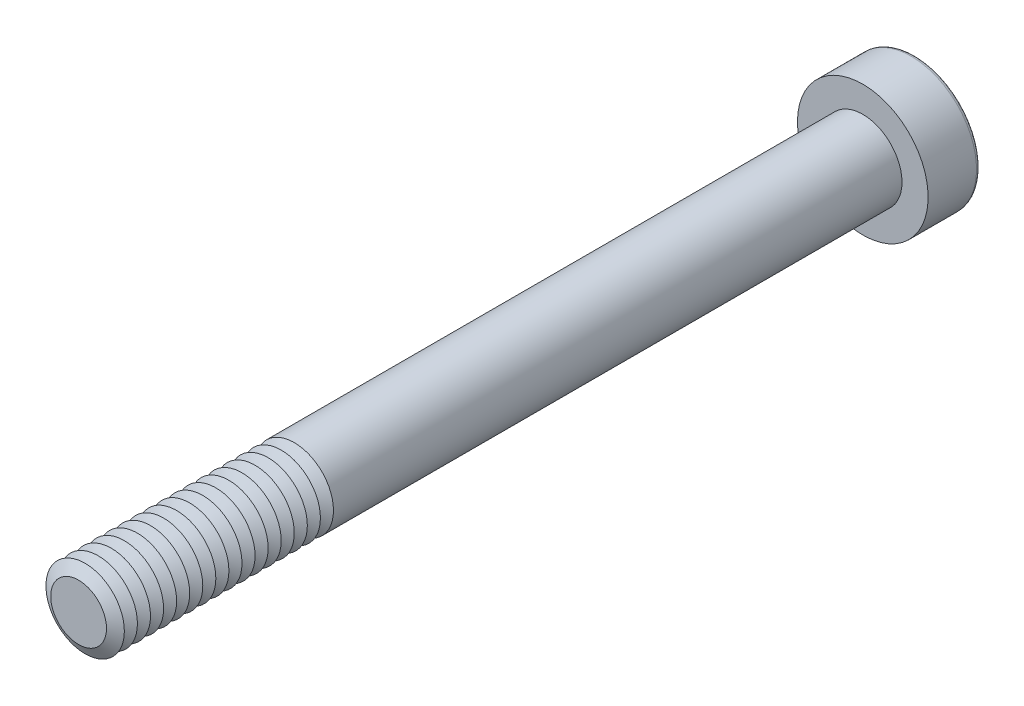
SolidWorks part; units mm, degrees
ref_plane "Front Plane" through (0, 0, 0) normal (0, 0, 1) x (1, 0, 0)
ref_plane "Top Plane" through (0, 0, 0) normal (0, 1, 0) x (1, 0, 0)
ref_plane "Right Plane" through (0, 0, 0) normal (1, 0, 0) x (0, 0, -1)
sketch "Sketch1" plane through (0, 0, 0) normal (0, 0, 1) x (1, 0, 0)
  circle A0 centre (0, 0) radius 3
  dimension "D1" = 6
extrude "Boss-Extrude1" add sketch "Sketch1" along normal blind 60
sketch "Sketch2" plane through (0, 0, 0) normal (0, 0, -1) x (-1, 0, 0)
  circle A0 centre (0, 0) radius 5
  dimension "D1" = 10
extrude "Boss-Extrude2" add sketch "Sketch2" along normal blind 4
sketch "Sketch3" plane through (0, 0, -4) normal (0, 0, -1) x (-1, 0, 0)
  line L1 (-1.1547, 2) -> (-2.3094, 0)
  line L2 (-2.3094, 0) -> (-1.1547, -2)
  line L3 (-1.1547, -2) -> (1.1547, -2)
  line L4 (1.1547, -2) -> (2.3094, 0)
  line L5 (2.3094, 0) -> (1.1547, 2)
  line L6 (1.1547, 2) -> (-1.1547, 2)
  circle A0 centre (0, 0) radius 2 construction
  dimension "D1" = 4
extrude "Cut-Extrude1" cut sketch "Sketch3" against normal blind 3
fillet "Fillet1" radius 0.3 1 edges at (-5, 0, -4)
sketch "Sketch4" plane through (0, 0, -1) normal (0, 0, -1) x (-1, 0, 0)
  line L0 (1.1547, -2) -> (2.3094, 0) construction
  circle A0 centre (0, 0) radius 2
extrude "Cut-Extrude2" cut sketch "Sketch4" against normal through all draft 60
sketch "Sketch5" plane through (0, 0, -4) normal (0, 0, -1) x (-1, 0, 0)
  circle A0 centre (0, 0) radius 2.3094
extrude "Cut-Extrude3" cut sketch "Sketch5" against normal through all draft 75
sketch "Sketch7" plane through (0, 0, 0) normal (1, 0, 0) x (0, 0, -1)
  line L25 (-60, 2.134) -> (-59.5, 3)
  line L26 (-60, 3) -> (-60, -3) construction
  line L27 (-59.5, 3) -> (-60.5, 3)
  line L28 (-60.5, 3) -> (-60, 2.134)
  line L29 (0, 3) -> (-60, 3) construction
  dimension "D1" = 1
revolve "Cut-Revolve1" cut sketch "Sketch7" angle 360 about axis through (0, 0, 60) along (0, 0, -1)
pattern_linear "LPattern1" count 17 spacing 1 along (0, 0, -1) of "Cut-Revolve1"
